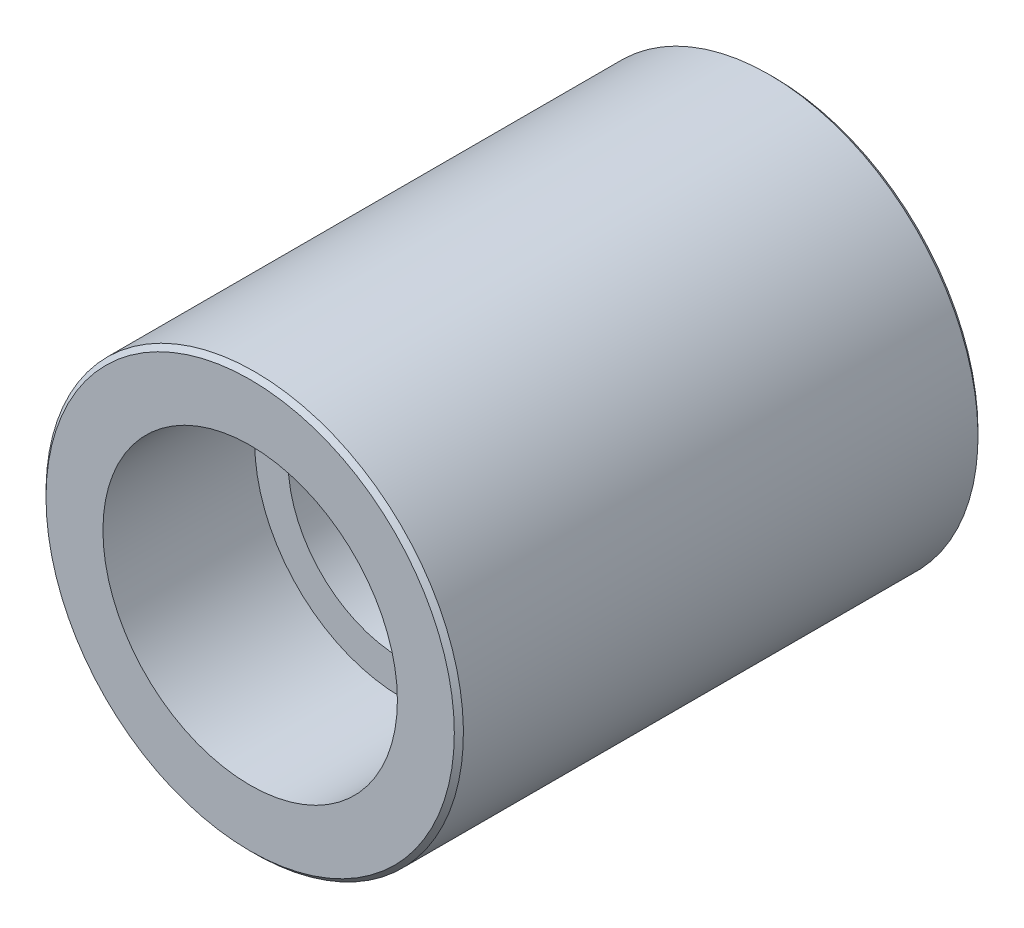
SolidWorks part; units mm, degrees
ref_plane "Front Plane" through (0, 0, 0) normal (0, 0, 1) x (1, 0, 0)
ref_plane "Top Plane" through (0, 0, 0) normal (0, 1, 0) x (1, 0, 0)
ref_plane "Right Plane" through (0, 0, 0) normal (1, 0, 0) x (0, 0, -1)
imported_body "Defeatured1"
sketch "Sketch1" plane through (0, 0, 7.2628) normal (0, 0, -1) x (-1, 0, 0)
  circle A0 centre (0, 0) radius 10.795
extrude "Cut-Extrude1" cut sketch "Sketch1" against normal offset from surface (20.6772 mm away) 3.175
